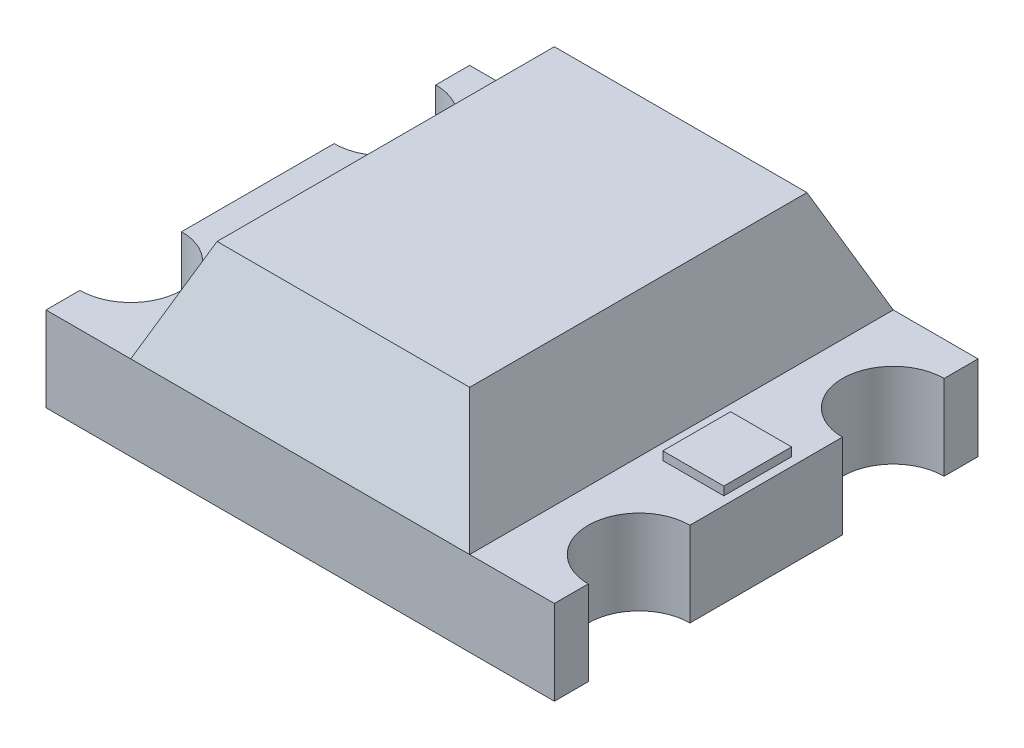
SolidWorks part; units mm, degrees
ref_plane "Front" through (0, 0, 0) normal (0, 0, 1) x (1, 0, 0)
ref_plane "Top" through (0, 0, 0) normal (0, 1, 0) x (1, 0, 0)
ref_plane "Right" through (0, 0, 0) normal (1, 0, 0) x (0, 0, -1)
sketch "Эскиз1" plane through (0, 0, 0) normal (0, 1, 0) x (1, 0, 0)
  line L0 (-1.5, 0) -> (0, 0) construction
  line L1 (-1.5, -1.25) -> (1.5, -1.25)
  line L2 (-1.5, -1.25) -> (-1.5, -1.05)
  line L3 (-1.5, 1.25) -> (1.5, 1.25)
  line L4 (1.5, -1.25) -> (1.5, -1.05)
  line L5 (0, 1.25) -> (0, -1.25) construction
  line L6 (-1.5, 1.05) -> (-1.5, 1.25)
  line L7 (-1.5, -0.45) -> (-1.5, 0.45)
  line L8 (1.5, 1.05) -> (1.5, 1.25)
  line L9 (1.5, -0.45) -> (1.5, 0.45)
  arc A0 (-1.5, -1.05) -> (-1.5, -0.45) centre (-1.5, -0.75) ccw
  arc A1 (-1.5, 1.05) -> (-1.5, 0.45) centre (-1.5, 0.75) cw
  arc A2 (1.5, -1.05) -> (1.5, -0.45) centre (1.5, -0.75) cw
  arc A3 (1.5, 1.05) -> (1.5, 0.45) centre (1.5, 0.75) ccw
  dimension "D1" = 0.3
  dimension "D2" = 1.5
  dimension "D3" = 2.5
  dimension "D4" = 3
extrude "Вытянуть1" add sketch "Эскиз1" along normal blind 0.5
sketch "Эскиз2" plane through (0, 0.5, 0) normal (0, 1, 0) x (-1, 0, 0)
  line L0 (1.5, 0) -> (-1.5, 0) construction
  line L1 (0.35, -0.9) -> (-0.35, -0.9) construction
  line L2 (0.35, -0.9) -> (0.35, -0.2) construction
  line L3 (0.35, -0.2) -> (-0.35, -0.2) construction
  line L4 (-0.35, -0.9) -> (-0.35, -0.2) construction
  line L5 (1.5, -0.45) -> (1.5, 0.45) construction
  line L6 (-1.5, 0.45) -> (-1.5, -0.45) construction
  line L7 (-0.35, 0.9) -> (-0.35, 0.2)
  line L8 (0.35, 0.2) -> (-0.35, 0.2)
  line L9 (0.35, 0.9) -> (0.35, 0.2)
  line L10 (0.35, 0.9) -> (-0.35, 0.9)
  point P10 (0, -0.2)
  dimension "D1" = 0.7
  dimension "D2" = 0.4
extrude "Вытянуть2" add sketch "Эскиз2" along normal blind 0.2
sketch "Sketch1" plane through (0, 0.5, 0) normal (0, 1, 0) x (1, 0, 0)
  line L1 (-0.35, 0.2) -> (0.35, 0.2)
  line L2 (-0.35, 0.2) -> (-0.35, 0.9)
  line L3 (-0.35, 0.9) -> (0.35, 0.9)
  line L4 (0.35, 0.2) -> (0.35, 0.9)
extrude "Extrude1" add sketch "Sketch1" along normal up to surface (0.2 mm away)
sketch "Sketch2" plane through (0, 0.5, 0) normal (0, 1, 0) x (1, 0, 0)
  line L1 (1.45, 0.2) -> (1.09, 0.2)
  line L2 (1.45, 0.2) -> (1.45, -0.2)
  line L3 (1.45, -0.2) -> (1.09, -0.2)
  line L4 (1.09, 0.2) -> (1.09, -0.2)
  line L6 (0, 0) -> (1.5, 0) construction
  line L7 (1.5, -0.45) -> (1.5, 0.45) construction
  dimension "D1" = 0.4
  dimension "D2" = 0.36
  dimension "D3" = 0.05
extrude "Extrude2" add sketch "Sketch2" along normal blind 0.05
sketch "Эскиз3" plane through (0, 0.5, 0) normal (0, 1, 0) x (-1, 0, 0)
  line L0 (-1.5, -1.25) -> (1.5, -1.25) construction
  line L1 (1, -1.25) -> (-1, -1.25)
  line L2 (1, -1.25) -> (1, 1.25)
  line L3 (1, 1.25) -> (-1, 1.25)
  line L4 (-1, -1.25) -> (-1, 1.25)
  line L5 (1.5, 1.25) -> (-1.5, 1.25) construction
  point P8 (0, -1.25)
  dimension "D1" = 2
extrude "Вытянуть4" add sketch "Эскиз3" along normal blind 0.6 draft 23 separate body
